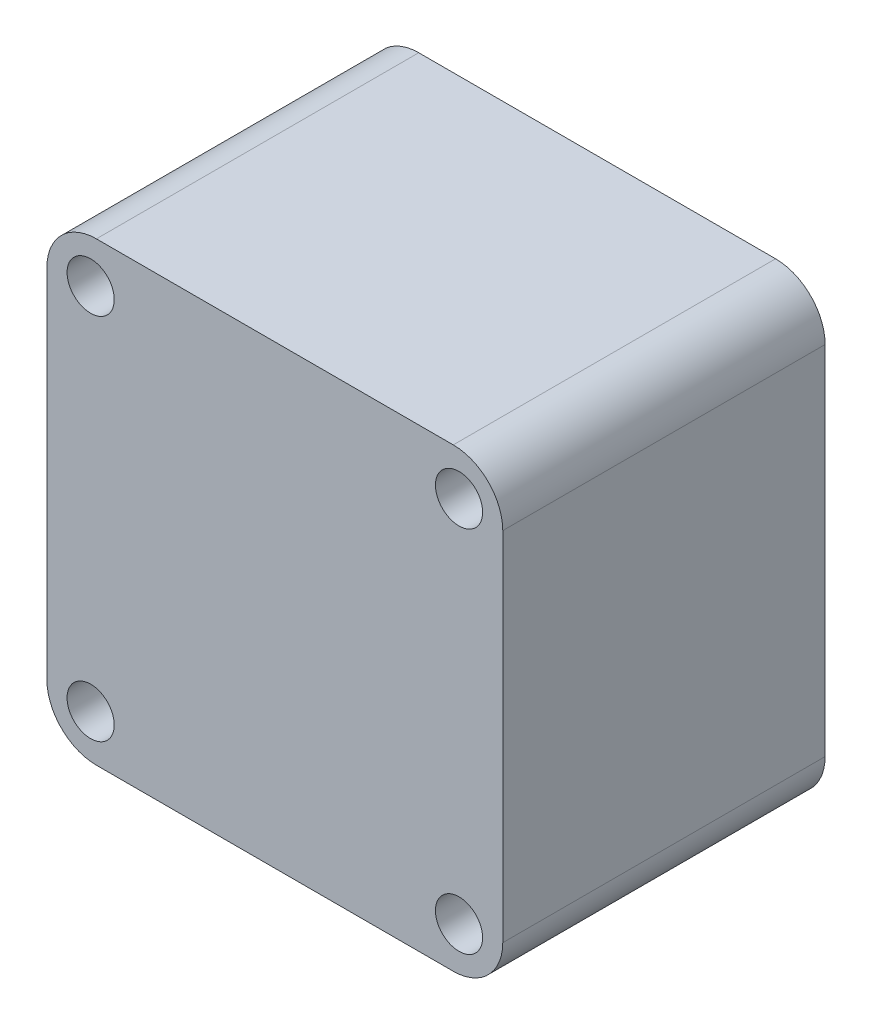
SolidWorks part; units mm, degrees
ref_plane "Front Plane" through (0, 0, 0) normal (0, 0, 1) x (1, 0, 0)
ref_plane "Top Plane" through (0, 0, 0) normal (0, 1, 0) x (1, 0, 0)
ref_plane "Right Plane" through (0, 0, 0) normal (1, 0, 0) x (0, 0, -1)
sketch "Sketch2" plane through (0, 0, 0) normal (0, 0, 1) x (1, 0, 0)
  line L17 (688.9707, 853.5877) -> (688.9707, 856.1877)
  line L34 (688.9707, 851.8349) -> (688.9707, 853.5877)
  line L36 (688.7707, 853.5877) -> (688.7707, 852.9877)
  line L37 (687.9645, 852.4877) -> (687.0989, 852.4877)
  line L38 (674.3411, 844.4965) -> (664.0003, 844.4965)
  line L39 (649.5795, 858.9173) -> (649.5795, 869.2581)
  line L40 (664.0003, 883.6789) -> (674.3411, 883.6789)
  line L41 (688.7619, 869.2581) -> (688.7619, 859.2877)
  line L42 (688.7619, 859.2877) -> (688.7707, 859.2877)
  line L43 (688.7707, 859.2877) -> (688.7707, 856.1877)
  line L45 (688.9707, 856.1877) -> (688.9707, 859.2877)
  line L46 (688.9707, 859.2877) -> (688.9707, 879.5877)
  line L47 (684.6707, 883.8877) -> (653.6707, 883.8877)
  line L48 (649.3707, 879.5877) -> (649.3707, 848.5877)
  line L49 (653.6707, 844.2877) -> (684.6707, 844.2877)
  line L50 (688.9707, 848.5877) -> (688.9707, 851.8349)
  arc A4 (683.1207, 848.0877) -> (687.2207, 848.0877) centre (685.1707, 848.0877) ccw
  arc A5 (687.2207, 848.0877) -> (683.1207, 848.0877) centre (685.1707, 848.0877) ccw
  arc A8 (683.1207, 880.0877) -> (687.2207, 880.0877) centre (685.1707, 880.0877) ccw
  arc A9 (687.2207, 880.0877) -> (683.1207, 880.0877) centre (685.1707, 880.0877) ccw
  arc A12 (651.1207, 880.0877) -> (655.2207, 880.0877) centre (653.1707, 880.0877) ccw
  arc A13 (655.2207, 880.0877) -> (651.1207, 880.0877) centre (653.1707, 880.0877) ccw
  arc A16 (651.1207, 848.0877) -> (655.2207, 848.0877) centre (653.1707, 848.0877) ccw
  arc A17 (655.2207, 848.0877) -> (651.1207, 848.0877) centre (653.1707, 848.0877) ccw
  arc A50 (685.5367, 852.1419) -> (687.0989, 852.4877) centre (682.4958, 869.5835) ccw
  arc A51 (684.8116, 851.2071) -> (685.5367, 852.1419) centre (669.1707, 864.0877) ccw
  arc A52 (684.8116, 851.2071) -> (682.0513, 848.4468) centre (685.1707, 848.0877) ccw
  arc A53 (674.3411, 844.4965) -> (682.0513, 848.4468) centre (669.1707, 864.0877) ccw
  arc A54 (656.2901, 848.4468) -> (664.0003, 844.4965) centre (669.1707, 864.0877) ccw
  arc A55 (656.2901, 848.4468) -> (653.5298, 851.2071) centre (653.1707, 848.0877) ccw
  arc A56 (649.5795, 858.9173) -> (653.5298, 851.2071) centre (669.1707, 864.0877) ccw
  arc A57 (653.5298, 876.9683) -> (649.5795, 869.2581) centre (669.1707, 864.0877) ccw
  arc A58 (653.5298, 876.9683) -> (656.2901, 879.7286) centre (653.1707, 880.0877) ccw
  arc A59 (664.0003, 883.6789) -> (656.2901, 879.7286) centre (669.1707, 864.0877) ccw
  arc A60 (682.0513, 879.7286) -> (674.3411, 883.6789) centre (669.1707, 864.0877) ccw
  arc A61 (682.0513, 879.7286) -> (684.8116, 876.9683) centre (685.1707, 880.0877) ccw
  arc A62 (688.7619, 869.2581) -> (684.8116, 876.9683) centre (669.1707, 864.0877) ccw
  arc A63 (688.9707, 879.5877) -> (684.6707, 883.8877) centre (684.6707, 879.5877) ccw
  arc A64 (653.6707, 883.8877) -> (649.3707, 879.5877) centre (653.6707, 879.5877) ccw
  arc A65 (649.3707, 848.5877) -> (653.6707, 844.2877) centre (653.6707, 848.5877) ccw
  arc A66 (684.6707, 844.2877) -> (688.9707, 848.5877) centre (684.6707, 848.5877) ccw
  spline S2 degree 2 poles (688.7707, 852.9877) (688.6629, 852.8672) (688.6039, 852.8081) (688.5079, 852.7122) (688.4188, 852.6484) (688.3139, 852.5733) (688.2037, 852.5324) (688.0834, 852.4877) (687.9645, 852.4877) knots 0 0 0 0.25 0.25 0.5 0.5 0.75 0.75 1 1 1
extrude "Boss-Extrude4" add sketch "Sketch2" against normal up to surface (28 mm away)
